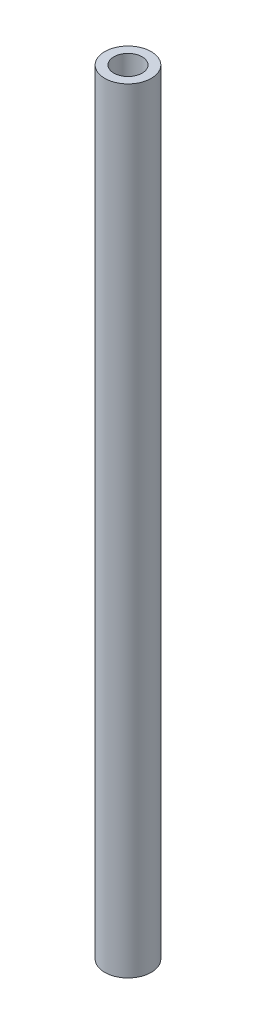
SolidWorks part; units mm, degrees
ref_plane "Plan1" through (0, 0, 0) normal (0, 0, 1) x (1, 0, 0)
ref_plane "Plan2" through (0, 0, 0) normal (0, 1, 0) x (1, 0, 0)
ref_plane "Plan3" through (0, 0, 0) normal (1, 0, 0) x (0, 0, -1)
sketch "Esquisse1" plane through (0, 0, 0) normal (0, 0, 1) x (1, 0, 0)
  line L0 (0, 119.7065) -> (0, -7.1601) construction
  line L1 (0, -50) -> (0, 50) construction
  line L2 (50, 0) -> (-50, 0) construction
  line L3 (15, 500) -> (9.15, 500)
  line L4 (15, 500) -> (15, 0)
  line L5 (15, 0) -> (9.15, 0)
  line L6 (9.15, 500) -> (9.15, 0)
  dimension "D1" = 18.3
  dimension "D2" = 30
  dimension "D3" = 500
revolve "Révolution1" add sketch "Esquisse1" angle 360 about L0
